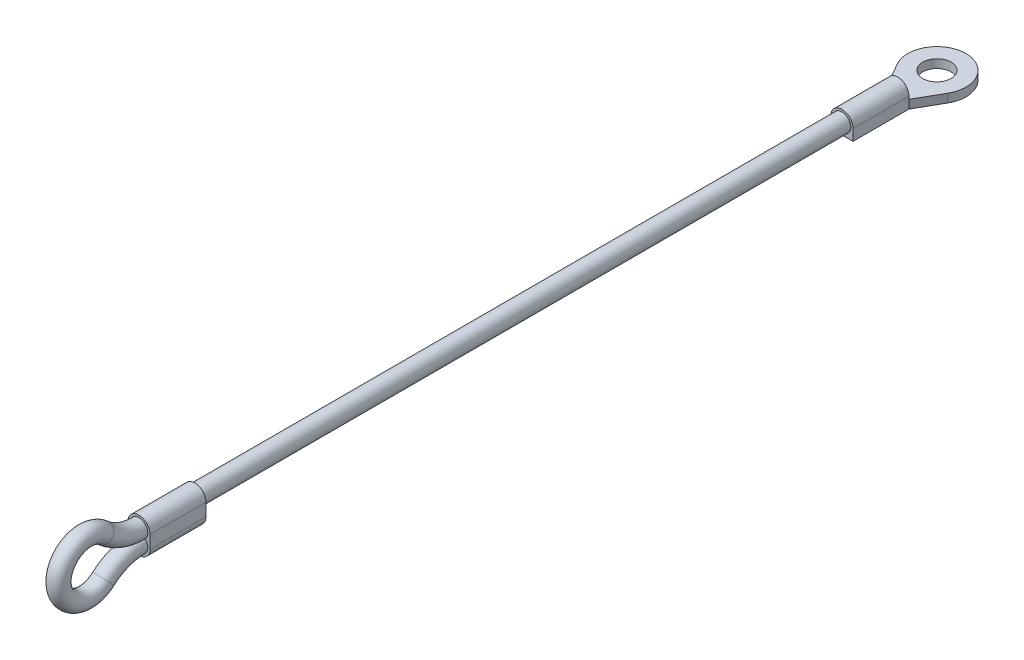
SolidWorks part; units mm, degrees
ref_plane "Front Plane" through (0, 0, 0) normal (0, 0, 1) x (1, 0, 0)
ref_plane "Top Plane" through (0, 0, 0) normal (0, 1, 0) x (1, 0, 0)
ref_plane "Right Plane" through (0, 0, 0) normal (1, 0, 0) x (0, 0, -1)
sketch "Sketch1" plane through (0, 0, 0) normal (1, 0, 0) x (0, 0, -1)
  line L2 (-125.8, 0) -> (0, 0)
  arc A0 (-125.8, 0) -> (-132.2, 2.4446) centre (-125.8, 9.6) cw
  arc A1 (-132.2, 2.4446) -> (-132.2, -4.7108) centre (-135.4, -1.1331) ccw
  arc A2 (-132.2, -4.7108) -> (-125.8, -2.2663) centre (-125.8, -11.8663) cw
  dimension "D1" = 4.8
  dimension "D4" = 9.6
  dimension "D2" = 135.4
  dimension "D3" = 9.6
sketch "Sketch2" plane through (0, 0, 0) normal (0, 0, 1) x (1, 0, 0)
  circle A0 centre (0, 0) radius 1.59
  dimension "D1" = 3.18
sweep "Sweep1" add profiles "Sketch2" path "Sketch1"
sketch "Sketch3" plane through (0, 0, 125.8) normal (0, 0, -1) x (-1, 0, 0)
  line L0 (0, 0) -> (0, -2.2663) construction
  line L1 (1.99, 0) -> (1.99, -2.2663)
  line L2 (-1.99, 0) -> (-1.99, -2.2663)
  line L3 (-1.59, -2.2663) -> (1.59, -2.2663) construction
  arc A0 (1.99, 0) -> (-1.99, 0) centre (0, 0) ccw
  arc A1 (-1.99, -2.2663) -> (1.99, -2.2663) centre (0, -2.2663) ccw
  point P3 (0, -1.1331)
  dimension "D1" = 3.98
extrude "Boss-Extrude1" add sketch "Sketch3" along normal blind 10
sketch "Sketch4" plane through (0, 0, 0) normal (0, 0, -1) x (-1, 0, 0)
  line L0 (-1.99, 0) -> (-1.99, -1.99)
  line L1 (-1.99, -1.99) -> (0, -1.99)
  line L2 (0, -1.99) -> (1.99, -1.99)
  line L3 (1.99, -1.99) -> (1.99, 0)
  arc A0 (1.99, 0) -> (-1.99, 0) centre (0, 0) ccw
  dimension "D1" = 3.98
extrude "Boss-Extrude2" add sketch "Sketch4" along normal blind 10
sketch "Sketch5" plane through (0, -1.99, 0) normal (0, -1, 0) x (1, 0, 0)
  line L0 (-1.99, -10) -> (1.99, -10)
  line L1 (1.99, -10) -> (4.5171, -14.4138)
  line L2 (-4.5171, -14.4138) -> (-1.99, -10)
  arc A0 (4.5171, -14.4138) -> (-4.5171, -14.4138) centre (0, -17) cw
  circle A1 centre (0, -17) radius 2.54
  point P8 (-5.205, -17)
  point P9 (5.205, -17)
  dimension "D1" = 5.08
  dimension "D2" = 10.41
  dimension "D3" = 17
extrude "Boss-Extrude3" add sketch "Sketch5" against normal blind 1.52
